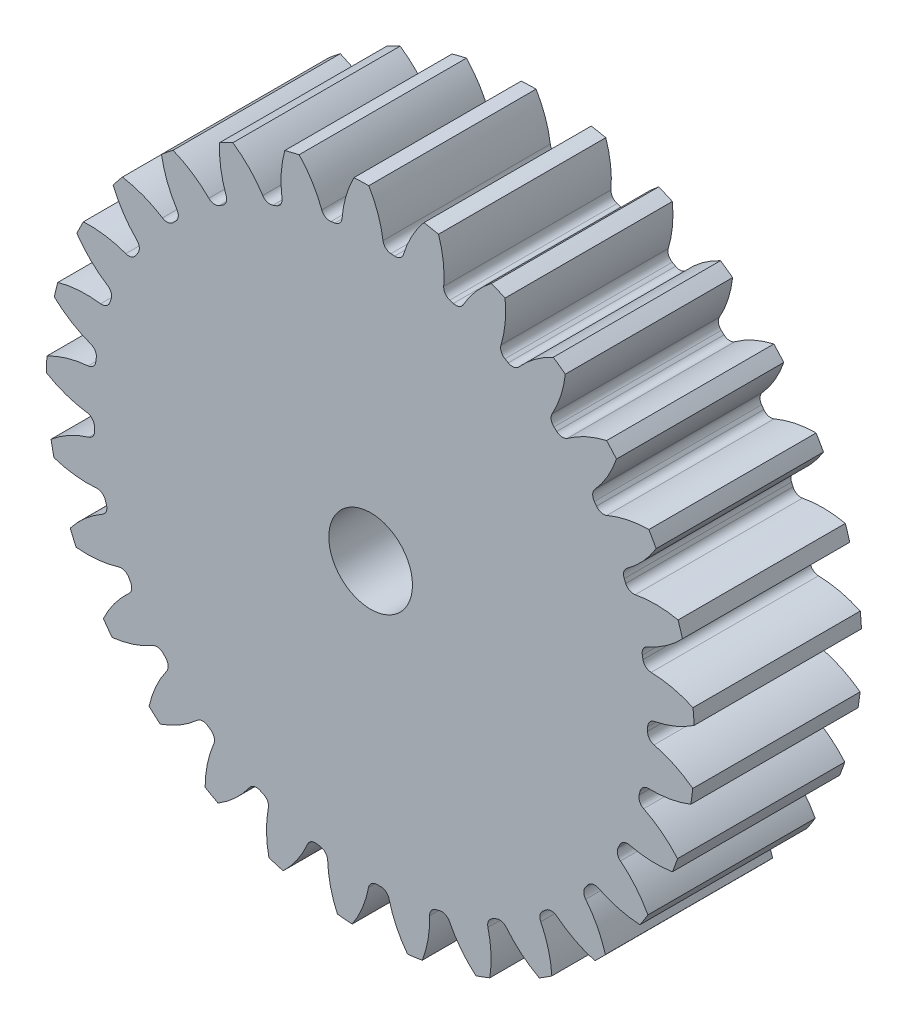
SolidWorks part; units mm, degrees
ref_plane "Front" through (0, 0, 0) normal (0, 0, 1) x (1, 0, 0)
ref_plane "Top" through (0, 0, 0) normal (0, 1, 0) x (1, 0, 0)
ref_plane "Right" through (0, 0, 0) normal (1, 0, 0) x (0, 0, -1)
sketch "Sketch3" plane through (0, 0, 0) normal (0, 0, 1) x (1, 0, 0)
  circle A0 centre (0, 0) radius 196.85
  dimension "od" = 393.7
extrude "gearBody" add sketch "Sketch3" along normal blind 101.6
sketch "Sketch2" plane through (0, 0, 0) normal (0, 0, 1) x (1, 0, 0)
  line L0 (0, 0) -> (159.8722, 66.2212) construction
  line L1 (195.9787, -22.0617) -> (0, 0) construction
  line L2 (0, 0) -> (36.3143, 0) construction
  line L3 (184.0756, 5.2343) -> (183.5677, -14.6329) construction
  line L5 (183.8216, -4.6993) -> (0, 0) construction
  line L7 (0, 0) -> (173.0444, 0) construction
  arc A0 (173.0335, 1.9407) -> (172.7083, -10.7794) centre (0, 0) ccw construction
  arc A1 (196.4972, 11.7802) -> (195.6386, -21.805) centre (0, 0) ccw construction
  arc A2 (184.0756, 5.2343) -> (183.5677, -14.6329) centre (0, 0) ccw construction
  arc A3 (168.1869, -5.4432) -> (168.2454, -3.1575) centre (0, 0) ccw
  arc A4 (195.9787, -22.0617) -> (172.1064, -10.6267) centre (156.2797, -74.3035) ccw
  arc A5 (195.9787, -22.0617) -> (196.85, 12.0193) centre (0, 0) ccw
  arc A6 (196.85, 12.0193) -> (172.4245, 1.819) centre (159.8722, 66.2212) cw
  arc A7 (168.2454, -3.1575) -> (172.4245, 1.819) centre (173.4134, -3.2545) cw
  arc A8 (172.1064, -10.6267) -> (168.1869, -5.4432) centre (173.3531, -5.6104) cw
  point P6 (196.85, 12.0193)
  point P22 (195.9787, -22.0617)
  dimension "baseDia" = 346.0888
  dimension "od" = 393.7
  dimension "pd" = 368.3
  dimension "rd" = 336.55
  dimension "rFillet" = 5.1689
  dimension "pointX" = 196.85
  dimension "pointY" = 12.0193
  dimension "CTT" = 19.8672
  dimension "flankCenterAngle" = 22.5
extrude "toothCut" cut sketch "Sketch2" along normal through all
pattern_circular "CirPattern1" count 29 over 360 about axis through (0, 0, 0) along (0, 0, 1) of "toothCut"
sketch "hub1Dia" plane through (0, 0, 0) normal (0, 0, -1) x (-1, 0, 0)
  circle A0 centre (0, 0) radius 12.7
  dimension "hub1Dia" = 25.4
sketch "hub2Dia" plane through (0, 0, 101.6) normal (0, 0, 1) x (1, 0, 0)
  circle A0 centre (0, 0) radius 12.7
  dimension "hub2dia" = 25.4
sketch "boreDia" plane through (0, 0, 0) normal (0, 0, 1) x (1, 0, 0)
  circle A0 centre (0, 0) radius 25.4
  dimension "boreDia" = 50.8
extrude "bore" cut sketch "boreDia" against normal mid plane 25400
